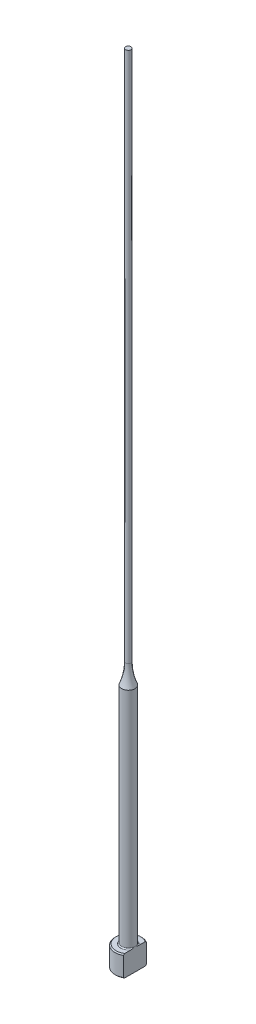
SolidWorks part; units mm, degrees
ref_plane "Front Plane" through (0, 0, 0) normal (0, 0, 1) x (1, 0, 0)
ref_plane "Top Plane" through (0, 0, 0) normal (0, 1, 0) x (1, 0, 0)
ref_plane "Right Plane" through (0, 0, 0) normal (1, 0, 0) x (0, 0, -1)
sketch "Sketch1" plane through (0, 0, 0) normal (0, 0, 1) x (1, 0, 0)
  line L0 (0, 259.9588) -> (0, -15.1925) construction
  line L1 (0, 0) -> (-2.5, 0)
  line L2 (-2.5, 0) -> (-2.5, 4)
  line L3 (-2.5, 4) -> (-1.25, 4)
  line L4 (-0.5, 50) -> (-0.5, 150)
  line L5 (-0.5, 150) -> (0, 150)
  line L6 (0, 150) -> (0, 0)
  line L7 (-1.25, 4) -> (-1.25, 46.2003)
  arc A0 (-1.25, 46.2003) -> (-0.5, 50) centre (-10.5, 50) ccw
  point P13 (-1.25, 0)
  dimension "D1" = 10
  dimension "L" = 150
  dimension "H" = 5
  dimension "T" = 4
  dimension "D" = 1
  dimension "B" = 2.5
  dimension "S" = 50
revolve "Revolve1" add sketch "Sketch1" angle 360 about L0
chamfer "Chamfer1" distance 0.2 angle 45 2 edges at (0, 4, 2.5) (0, 0, 2.5)
fillet "Fillet1" radius 0.2 1 edges at (0, 4, 1.25)
sketch "Sketch2" plane through (0, 0, 0) normal (0, 1, 0) x (1, 0, 0)
  line L0 (1.25, -2.1651) -> (1.25, 2.1651)
  circle A0 centre (0, 0) radius 2.5 construction
  arc A1 (1.25, -2.1651) -> (1.25, 2.1651) centre (0, 0) ccw
  circle A2 centre (0, 0) radius 1.25 construction
extrude "Keyed Head" cut sketch "Sketch2" along normal through all
